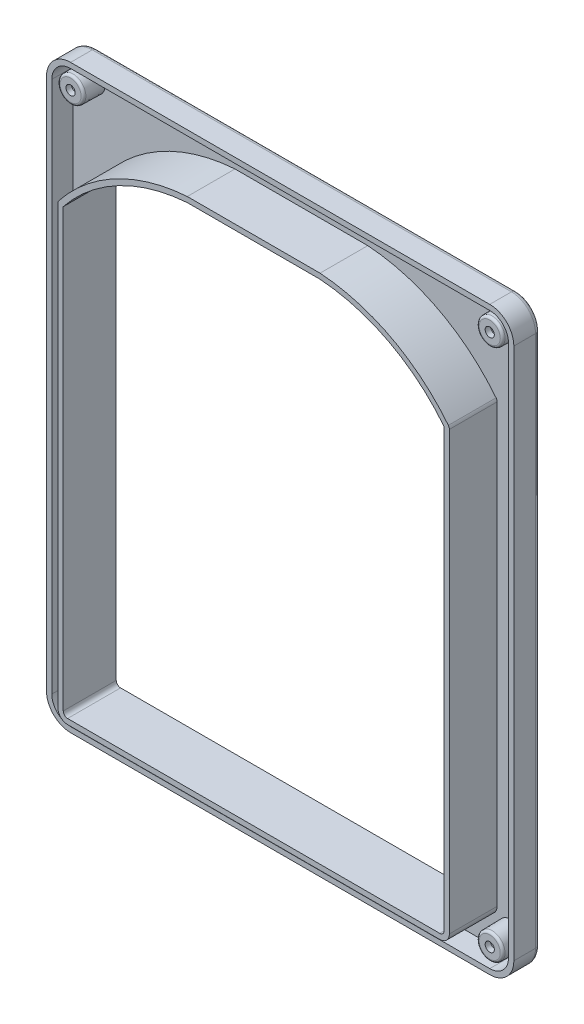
SolidWorks part; units mm, degrees
ref_plane "Face" through (0, 0, 0) normal (0, 0, 1) x (1, 0, 0)
ref_plane "Dessus" through (0, 0, 0) normal (0, 1, 0) x (1, 0, 0)
ref_plane "Droite" through (0, 0, 0) normal (1, 0, 0) x (0, 0, -1)
sketch "Esquisse1" plane through (0, 0, 0) normal (0, 0, 1) x (1, 0, 0)
  line L0 (0, 0) -> (39.8094, 0) construction
  line L1 (-77.25, -107.35) -> (77.25, -107.35)
  line L2 (-81.25, -103.35) -> (-81.25, 78.0298)
  line L3 (-27.5614, 107.35) -> (27.5614, 107.35)
  line L4 (81.25, -103.35) -> (81.25, 78.0298)
  line L5 (0, 0) -> (0, 53.9116) construction
  line L6 (-77.25, -105.15) -> (77.25, -105.15)
  line L7 (79.05, -103.35) -> (79.05, 77.9601)
  line L8 (-27.4841, 105.15) -> (27.4841, 105.15)
  line L9 (-79.05, -103.35) -> (-79.05, 77.9601)
  arc A0 (-80.8174, 79.2721) -> (-27.5614, 107.35) centre (-22.3628, 32.9449) cw
  arc A1 (80.8174, 79.2721) -> (27.5614, 107.35) centre (22.3628, 32.9449) ccw
  arc A2 (-81.25, 78.0298) -> (-80.8174, 79.2721) centre (-79.25, 78.0298) cw
  arc A3 (81.25, 78.0298) -> (80.8174, 79.2721) centre (79.25, 78.0298) ccw
  arc A4 (81.25, -103.35) -> (77.25, -107.35) centre (77.25, -103.35) cw
  arc A5 (-81.25, -103.35) -> (-77.25, -107.35) centre (-77.25, -103.35) ccw
  arc A6 (79.05, -103.35) -> (77.25, -105.15) centre (77.25, -103.35) cw
  arc A7 (79.05, 77.9601) -> (79.05, 77.9601) centre (79.05, 77.9601) ccw
  arc A8 (79.05, 77.9601) -> (27.4841, 105.15) centre (22.3628, 32.9449) ccw
  arc A9 (-79.05, 77.9601) -> (-27.4841, 105.15) centre (-22.3628, 32.9449) cw
  arc A10 (-79.05, 77.9601) -> (-79.05, 77.9601) centre (-79.05, 77.9601) cw
  arc A11 (-79.05, -103.35) -> (-77.25, -105.15) centre (-77.25, -103.35) ccw
  point P7 (-81.25, 78.721)
  point P16 (81.25, 78.721)
  point P19 (81.25, -107.35)
  point P22 (-81.25, -107.35)
  dimension "D1" = 2
  dimension "D3" = 4
  dimension "D2" = 162.5
  dimension "D4" = 2.2
extrude "Extrusion1" add sketch "Esquisse1" along normal blind 22
sketch "Esquisse2" plane through (0, 0, 0) normal (0, 0, 1) x (1, 0, 0)
  line L0 (0, 0) -> (0, -42.3636) construction
  line L1 (-87, 120.35) -> (87, 120.35)
  line L2 (-97, 110.35) -> (-97, -110.65)
  line L3 (-87, -120.65) -> (87, -120.65)
  line L4 (97, 110.35) -> (97, -110.65)
  line L5 (-77.25, -105.15) -> (77.25, -105.15) construction
  line L6 (79.05, -103.35) -> (79.05, 77.9601) construction
  line L7 (-79.05, 77.9601) -> (-79.05, -103.35) construction
  line L8 (27.4841, 105.15) -> (-27.4841, 105.15) construction
  line L9 (-77.25, -105.15) -> (77.25, -105.15)
  line L10 (79.05, -103.35) -> (79.05, 77.9601)
  line L11 (-79.05, 77.9601) -> (-79.05, -103.35)
  line L12 (27.4841, 105.15) -> (-27.4841, 105.15)
  circle A0 centre (87, 110.35) radius 3.5 construction
  circle A1 centre (-87, 110.35) radius 3.5 construction
  circle A2 centre (-87, -110.65) radius 3.5 construction
  circle A3 centre (87, -110.65) radius 3.5 construction
  arc A4 (87, -120.65) -> (97, -110.65) centre (87, -110.65) ccw
  arc A5 (-97, -110.65) -> (-87, -120.65) centre (-87, -110.65) ccw
  arc A6 (-87, 120.35) -> (-97, 110.35) centre (-87, 110.35) ccw
  arc A7 (87, 120.35) -> (97, 110.35) centre (87, 110.35) cw
  circle A8 centre (87, 110.35) radius 1.75
  circle A9 centre (87, -110.65) radius 1.75
  circle A10 centre (-87, 110.35) radius 1.75
  circle A11 centre (-87, -110.65) radius 1.75
  arc A12 (-27.4841, 105.15) -> (-79.05, 77.9601) centre (-22.3628, 32.9449) ccw construction
  arc A13 (79.05, 77.9601) -> (27.4841, 105.15) centre (22.3628, 32.9449) ccw construction
  arc A14 (-27.4841, 105.15) -> (-79.05, 77.9601) centre (-22.3628, 32.9449) ccw
  arc A15 (79.05, 77.9601) -> (27.4841, 105.15) centre (22.3628, 32.9449) ccw
  arc A16 (-79.05, -103.35) -> (-77.25, -105.15) centre (-77.25, -103.35) ccw construction
  arc A17 (-79.05, -103.35) -> (-77.25, -105.15) centre (-77.25, -103.35) ccw
  arc A18 (77.25, -105.15) -> (79.05, -103.35) centre (77.25, -103.35) ccw construction
  arc A19 (77.25, -105.15) -> (79.05, -103.35) centre (77.25, -103.35) ccw
  point P6 (0, -120.65)
  point P19 (97, -120.65)
  point P24 (-97, 120.35)
  point P27 (97, 120.35)
  dimension "D4" = 7
  dimension "D5" = 10
  dimension "D7" = 10
  dimension "D9" = 10
  dimension "D10" = 3.5
  dimension "D11" = 3.5
  dimension "D12" = 3.5
  dimension "D1" = 194
  dimension "D2" = 241
  dimension "D3" = 15.5
  dimension "D6" = 10
  dimension "D8" = 10
extrude "Extrusion2" add sketch "Esquisse2" along normal blind 2.2
sketch "Esquisse3" plane through (0, 0, 2.2) normal (0, 0, 1) x (1, 0, 0)
  line L4 (97, -110.65) -> (97, 110.35)
  line L5 (87, 120.35) -> (-87, 120.35)
  line L6 (-97, 110.35) -> (-97, -110.65)
  line L7 (-87, -120.65) -> (87, -120.65)
  line L8 (97, -110.65) -> (97, 110.35)
  line L9 (87, 120.35) -> (-87, 120.35)
  line L10 (-97, 110.35) -> (-97, -110.65)
  line L11 (-87, -120.65) -> (87, -120.65)
  arc A4 (87, -120.65) -> (97, -110.65) centre (87, -110.65) ccw
  arc A5 (97, 110.35) -> (87, 120.35) centre (87, 110.35) ccw
  arc A6 (-87, 120.35) -> (-97, 110.35) centre (-87, 110.35) ccw
  arc A7 (-97, -110.65) -> (-87, -120.65) centre (-87, -110.65) ccw
  arc A8 (87, -120.65) -> (97, -110.65) centre (87, -110.65) ccw
  arc A9 (97, 110.35) -> (87, 120.35) centre (87, 110.35) ccw
  arc A10 (-87, 120.35) -> (-97, 110.35) centre (-87, 110.35) ccw
  arc A11 (-97, -110.65) -> (-87, -120.65) centre (-87, -110.65) ccw
  dimension "D1" = 0
extrude "Extru.-Mince1" add sketch "Esquisse3" along normal blind 8.8 thin
fillet "Congé1" radius 2 8 edges at (94.0711, -117.7211, 0) (97, -0.15, 0) (94.0711, 117.4211, 0) (0, 120.35, 0) (-94.0711, 117.4211, 0) (-97, -0.15, 0) (-94.0711, -117.7211, 0) (0, -120.65, 0)
sketch "Esquisse4" plane through (0, 0, 2.2) normal (0, 0, 1) x (1, 0, 0)
  circle A0 centre (87, 110.35) radius 1.75 construction
  circle A1 centre (87, 110.35) radius 1.75
  circle A2 centre (87, 110.35) radius 5.5
  circle A3 centre (-87, 110.35) radius 5.5
  circle A4 centre (-87, 110.35) radius 1.75 construction
  circle A5 centre (-87, -110.65) radius 5.5
  circle A6 centre (-87, -110.65) radius 1.75 construction
  circle A7 centre (87, -110.65) radius 5.5
  circle A8 centre (87, -110.65) radius 1.75 construction
  circle A9 centre (87, -110.65) radius 1.75
  circle A10 centre (-87, -110.65) radius 1.75
  circle A11 centre (-87, 110.35) radius 1.75
  dimension "D1" = 11
extrude "Extrusion3" add sketch "Esquisse4" along normal up to surface (8.8 mm away) draft 1
fillet "Congé2" radius 1 4 edges at (92.3464, 110.35, 11) (-81.6536, 110.35, 11) (-81.6536, -110.65, 11) (92.3464, -110.65, 11)
sketch "Esquisse5" plane through (0, 0, 0) normal (0, 0, -1) x (-1, 0, 0)
  circle A0 centre (87, -110.65) radius 1.75 construction
  circle A1 centre (-87, -110.65) radius 1.75 construction
  circle A2 centre (-87, 110.35) radius 1.75 construction
  circle A3 centre (87, 110.35) radius 1.75 construction
  circle A4 centre (87, -110.65) radius 1.75
  circle A5 centre (-87, -110.65) radius 1.75
  circle A6 centre (-87, 110.35) radius 1.75
  circle A7 centre (87, 110.35) radius 1.75
  circle A8 centre (87, 110.35) radius 3.675
  circle A9 centre (-87, 110.35) radius 3.675
  circle A10 centre (-87, -110.65) radius 3.675
  circle A11 centre (87, -110.65) radius 3.675
  dimension "D1" = 7.35
extrude "Enlèv. mat.-Extru.1" cut sketch "Esquisse5" against normal offset from surface (8.8 mm away) 2.2
fillet "Congé3" radius 0.5 4 edges at (-90.675, 110.35, 0) (83.325, 110.35, 0) (83.325, -110.65, 0) (-90.675, -110.65, 0)
